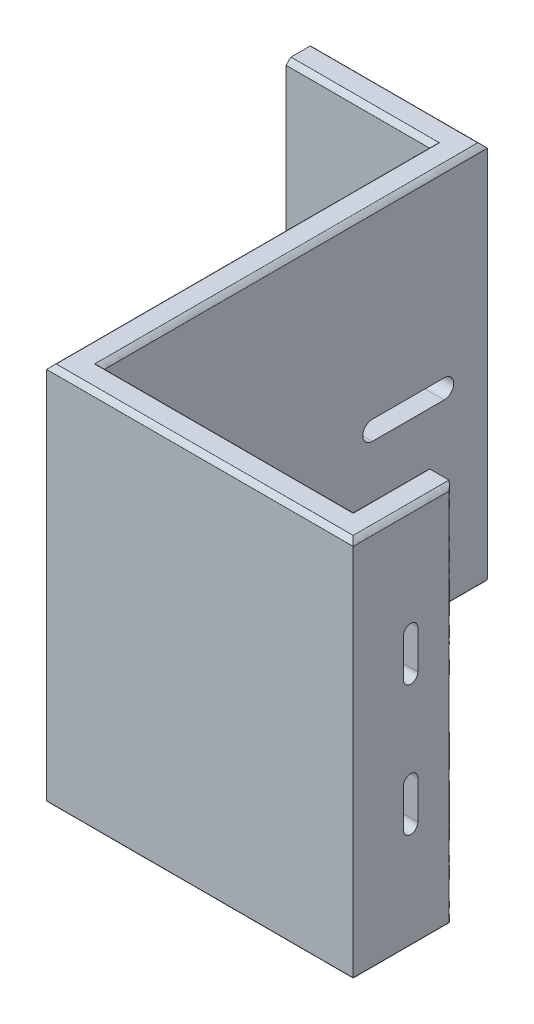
SolidWorks part; units mm, degrees
ref_plane "Front Plane" through (0, 0, 0) normal (0, 0, 1) x (1, 0, 0)
ref_plane "Top Plane" through (0, 0, 0) normal (0, 1, 0) x (1, 0, 0)
ref_plane "Right Plane" through (0, 0, 0) normal (1, 0, 0) x (0, 0, -1)
sketch "Sketch4" plane through (0, 0, 0) normal (0, 1, 0) x (1, 0, 0)
  line L0 (0, 20.4706) -> (0, -59.5294)
  line L1 (0, -59.5294) -> (58, -59.5294)
  line L3 (58, -53.5294) -> (6, -53.5294)
  line L4 (6, -53.5294) -> (6, 26.4706)
  line L5 (6, 26.4706) -> (-30, 26.4706)
  line L6 (-30, 26.4706) -> (-30, 20.4706)
  line L7 (-30, 20.4706) -> (0, 20.4706)
  line L8 (58, -53.5294) -> (58, -38.5294)
  line L9 (58, -38.5294) -> (64, -38.5294)
  line L10 (64, -38.5294) -> (64, -59.5294)
  line L11 (64, -59.5294) -> (58, -59.5294)
  dimension "D1" = 6
  dimension "D2" = 6
  dimension "D3" = 6
  dimension "D4" = 30
  dimension "D5" = 52
  dimension "D6" = 6
  dimension "D7" = 15
  dimension "D8" = 80
extrude "Boss-Extrude3" add sketch "Sketch4" along normal blind 80
sketch "Sketch6" plane through (6, 0, 0) normal (1, 0, 0) x (0, 0, -1)
  line L0 (-13.5294, 80) -> (-13.5294, -49920) construction
  line L1 (-53.5294, 80) -> (26.4706, 80) construction
  line L2 (-53.5294, 0) -> (26.4706, 0) construction
  line L3 (26.4706, 40) -> (-49973.5294, 40) construction
  line L4 (26.4706, 80) -> (26.4706, 0) construction
  line L5 (-59.5294, 80) -> (-59.5294, 0) construction
  line L6 (2.4706, 40) -> (17.4706, 40) construction
  line L7 (2.4706, 42) -> (17.4706, 42)
  line L8 (2.4706, 38) -> (17.4706, 38)
  line L9 (-29.5294, 40) -> (-44.5294, 40) construction
  line L10 (-29.5294, 42) -> (-44.5294, 42)
  line L11 (-29.5294, 38) -> (-44.5294, 38)
  arc A0 (2.4706, 42) -> (2.4706, 38) centre (2.4706, 40) ccw
  arc A1 (17.4706, 38) -> (17.4706, 42) centre (17.4706, 40) ccw
  arc A2 (-29.5294, 42) -> (-29.5294, 38) centre (-29.5294, 40) cw
  arc A3 (-44.5294, 38) -> (-44.5294, 42) centre (-44.5294, 40) cw
  point P4 (-13.5294, 80)
  point P7 (-13.5294, 0)
  point P12 (26.4706, 40)
  point P15 (-59.5294, 40)
  point P18 (9.9706, 40)
  point P25 (-37.0294, 40)
  dimension "D1" = 15
  dimension "D2" = 9
  dimension "D3" = 4
extrude "Cut-Extrude1" cut sketch "Sketch6" against normal blind 6
fillet "Fillet3" radius 1 18 edges at (-15, 80, -20.4706) (6, 80, 13.5294) (-12, 80, -26.4706) (32, 80, 53.5294) (58, 80, 46.0294) (58, 40, 38.5294) (58, 0, 46.0294) (32, 0, 53.5294) (6, 0, 13.5294) (-12, 0, -26.4706) (-15, 0, -20.4706) (0, 0, 19.5294) (32, 0, 59.5294) (64, 0, 49.0294) (64, 40, 38.5294) (0, 80, 19.5294) (32, 80, 59.5294) (64, 80, 49.0294)
sketch "Sketch8" plane through (64, 0, 0) normal (1, 0, 0) x (0, 0, -1)
  line L0 (-39.5294, 40) -> (-59.5294, 40) construction
  line L1 (-39.5294, 1) -> (-39.5294, 79) construction
  line L2 (-59.5294, 79) -> (-59.5294, 1) construction
  line L3 (-53.5294, 79) -> (-53.5294, 1)
  line L4 (-39.5294, 79) -> (-59.5294, 79) construction
  line L5 (-59.5294, 1) -> (-39.5294, 1) construction
  line L6 (-38.5294, 80) -> (-38.5294, 0) construction
  line L8 (-53.5294, 52.0089) -> (-47.5294, 52.0089) construction
  line L9 (-47.5294, 52.0089) -> (-47.5294, 50052.0089) construction
  line L11 (-47.5294, 22.4097) -> (-47.5294, 30.4097) construction
  line L12 (-49.0294, 22.4097) -> (-49.0294, 30.4097)
  line L13 (-46.0294, 22.4097) -> (-46.0294, 30.4097)
  line L14 (-47.5294, 57.5903) -> (-47.5294, 49.5903) construction
  line L15 (-49.0294, 57.5903) -> (-49.0294, 49.5903)
  line L16 (-46.0294, 57.5903) -> (-46.0294, 49.5903)
  arc A0 (-49.0294, 22.4097) -> (-46.0294, 22.4097) centre (-47.5294, 22.4097) ccw
  arc A1 (-46.0294, 30.4097) -> (-49.0294, 30.4097) centre (-47.5294, 30.4097) ccw
  arc A2 (-49.0294, 57.5903) -> (-46.0294, 57.5903) centre (-47.5294, 57.5903) cw
  arc A3 (-46.0294, 49.5903) -> (-49.0294, 49.5903) centre (-47.5294, 49.5903) cw
  point P23 (-47.5294, 26.4097)
  point P30 (-47.5294, 53.5903)
  dimension "D1" = 6
  dimension "D2" = 15
  dimension "D3" = 6
  dimension "D5" = 3
  dimension "D6" = 8
extrude "Cut-Extrude2" cut sketch "Sketch8" against normal blind 6 contours L13 A1 L12 A0 | L16 A3 L15 A2
sketch "Sketch9" plane through (0, 0, 53.5294) normal (0, 0, -1) x (-1, 0, 0)
  line L0 (-32, 1) -> (-32, 50001) construction
  line L1 (-58, 1) -> (-6, 1) construction
  line L2 (-6, 79) -> (-58, 79) construction
  line L3 (-6, 40) -> (-56.1331, 40) construction
  line L4 (-6, 79) -> (-6, 1) construction
  point P4 (-32, 1)
  point P7 (-32, 79)
